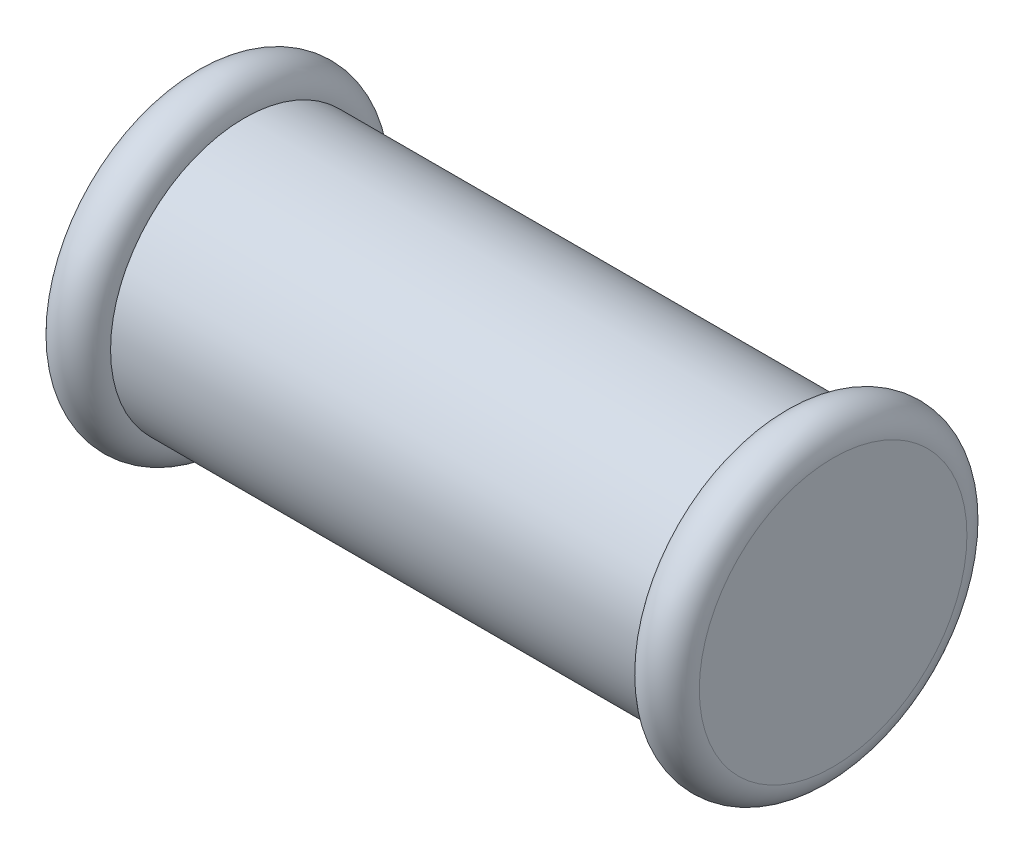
SolidWorks part; units mm, degrees
ref_plane "Front Plane" through (0, 0, 0) normal (0, 0, 1) x (1, 0, 0)
ref_plane "Top Plane" through (0, 0, 0) normal (0, 1, 0) x (1, 0, 0)
ref_plane "Right Plane" through (0, 0, 0) normal (1, 0, 0) x (0, 0, -1)
sketch "Sketch1" plane through (0, 0, 0) normal (0, 0, 1) x (1, 0, 0)
  line L0 (-31.6037, 0) -> (17.4705, 0) construction
  line L1 (4, 10) -> (44, 10)
  line L2 (0, 10) -> (0, 0)
  line L3 (0, 0) -> (48, 0)
  line L4 (48, 0) -> (48, 10)
  arc A0 (4, 10) -> (0, 10) centre (2, 10) ccw
  arc A1 (44, 10) -> (48, 10) centre (46, 10) cw
  dimension "D2" = 2
  dimension "D3" = 2
  dimension "D1" = 48
  dimension "D4" = 20
revolve "Revolve1" add sketch "Sketch1" angle 360 about L0
